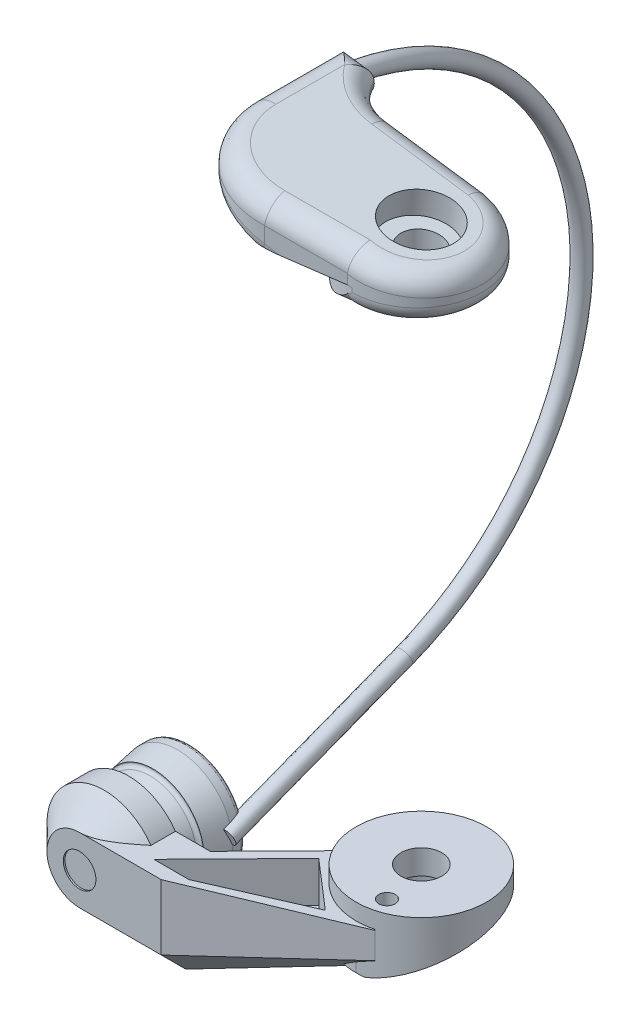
SolidWorks part; units mm, degrees
ref_plane "Plan1" through (0, 0, 0) normal (0, 0, 1) x (1, 0, 0)
ref_plane "Plan2" through (0, 0, 0) normal (0, 1, 0) x (1, 0, 0)
ref_plane "Plan3" through (0, 0, 0) normal (1, 0, 0) x (0, 0, -1)
sketch "Esquisse1" plane through (0, 0, 0) normal (0, 0, 1) x (1, 0, 0)
  circle A0 centre (0, 0) radius 7
  dimension "D1" = 14
extrude "Base-Extrusion" add sketch "Esquisse1" along normal blind 6
chamfer "Chanfrein1" distance 3 angle 45 1 edges at (7, 0, 6)
sketch "Esquisse2" plane through (0, 0, 0) normal (1, 0, 0) x (0, 0, -1)
  line L0 (-6, 4) -> (0, 4)
  line L1 (0, -7) -> (0, 7) construction
  line L2 (0, 4) -> (0, -7)
  line L3 (-3, -7) -> (-6, -4)
  line L4 (-3, -7) -> (-3, 7) construction
  line L5 (-6, -4) -> (-6, 4)
  line L6 (0, -7) -> (-3, -7)
extrude "Boss.-Extru.1" add sketch "Esquisse2" along normal blind 10
sketch "Esquisse3" plane through (0, 0, 0) normal (1, 0, 0) x (0, 0, -1)
  line L0 (9, 7.1) -> (9, -7) construction
ref_plane "Plan5" through (4.5, 0, -4.5) normal (0.7071, 0, -0.7071) x (-0.7071, 0, -0.7071)
ref_plane "Plan6" through (15.1066, 0, -15.1066) normal (0.7071, 0, -0.7071) x (-0.7071, 0, -0.7071)
sketch "Esquisse4" plane through (15.1066, 0, -15.1066) normal (0.7071, 0, -0.7071) x (-0.7071, 0, -0.7071)
  line L0 (-18.9434, 4) -> (-6.9434, 4)
  line L1 (-6.9434, 4) -> (-6.9434, -1.2)
  line L3 (-18.9434, 4) -> (-18.9434, 0.7848)
  line L5 (-6.9434, -1.2) -> (-16.7559, -1.2)
  line L6 (-18.9434, 0.7848) -> (-16.7559, -1.2)
  dimension "D1" = 12
sketch "Esquisse5" plane through (10, 0, 0) normal (1, 0, 0) x (0, 0, -1)
  line L0 (0, -7) -> (0, 4)
  line L1 (0, 4) -> (-6, 4)
  line L2 (-6, 4) -> (-6, -4)
  line L3 (-6, -4) -> (-3, -7)
  line L4 (-3, -7) -> (0, -7)
loft "Boss.-Lissage1" add profiles "Esquisse5", "Esquisse4"
sketch "Esquisse6" plane through (0, 4, 0) normal (0, 1, 0) x (-1, 0, 0)
  circle A0 centre (-26.3223, -9.5465) radius 8
  dimension "D1" = 16
  dimension "D2" = 28
extrude "Boss.-Extru.2" add sketch "Esquisse6" against normal blind 5.5
sketch "Esquisse7" plane through (0, -1.5, 0) normal (0, -1, 0) x (1, 0, 0)
  circle A0 centre (26.3223, -9.5465) radius 2.5
  dimension "D1" = 5
extrude "Enlèv. mat.-Extru.1" cut sketch "Esquisse7" against normal through all
sketch "Esquisse8" plane through (0, -1.5, 0) normal (0, -1, 0) x (1, 0, 0)
  circle A0 centre (26.3223, -9.5465) radius 4
  dimension "D1" = 8
extrude "Enlèv. mat.-Extru.2" cut sketch "Esquisse8" against normal blind 4.5
ref_plane "Plan7" through (8.3879, 0, 8.3879) normal (-0.7071, 0, -0.7071) x (-0.7071, 0, 0.7071)
sketch "Esquisse9" plane through (8.3879, 0, 8.3879) normal (-0.7071, 0, -0.7071) x (-0.7071, 0, 0.7071)
  line L0 (-20.5149, -1.5) -> (-33.3631, 3.7616)
  line L1 (-33.3631, 4) -> (-33.3631, -1.5) construction
  line L2 (-33.3631, 3.7616) -> (-33.3631, -1.5)
  line L3 (-33.3631, -1.5) -> (-20.5149, -1.5)
extrude "Enlèv. mat.-Extru.3" cut sketch "Esquisse9" against normal mid plane 18.5
sketch "Esquisse10" plane through (0, 4, 0) normal (0, 1, 0) x (-1, 0, 0)
  circle A0 centre (-26.3223, -9.5465) radius 8
extrude "Boss.-Extru.3" add sketch "Esquisse10" along normal blind 2
sketch "Esquisse11" plane through (0, 4, 0) normal (0, -1, 0) x (1, 0, 0)
  circle A0 centre (26.3223, -9.5465) radius 2.5
extrude "Enlèv. mat.-Extru.4" cut sketch "Esquisse11" against normal through all
sketch "Esquisse12" plane through (0, 4, 0) normal (0, 1, 0) x (-1, 0, 0)
  line L0 (-17.4, -5.9) -> (-23.3, -0.8)
  line L1 (-23.3, -0.8) -> (-11.7, 4.3)
  line L2 (-17.4, -5.9) -> (-7.3943, 4.3)
  line L3 (-7.3943, 4.3) -> (-11.7, 4.3)
extrude "Enlèv. mat.-Extru.6" cut sketch "Esquisse12" against normal blind 5
sketch "Esquisse13" plane through (0, 0, 0) normal (0, 0, -1) x (-1, 0, 0)
  circle A0 centre (0, 0) radius 5
  dimension "D1" = 10
extrude "Boss.-Extru.4" add sketch "Esquisse13" along normal blind 3 draft 15
sketch "Esquisse14" plane through (0, 0, -3) normal (0, 0, -1) x (-1, 0, 0)
  circle A0 centre (0, 0) radius 6.25
  dimension "D1" = 12.5
extrude "Boss.-Extru.5" add sketch "Esquisse14" along normal blind 3 draft 10
sketch "Esquisse15" plane through (0, 0, -6) normal (0, 0, -1) x (-1, 0, 0)
  circle A0 centre (0, 0) radius 6.779
extrude "Boss.-Extru.6" add sketch "Esquisse15" along normal blind 1.5
sketch "Esquisse16" plane through (0, 0, -7.5) normal (0, 0, -1) x (-1, 0, 0)
  circle A0 centre (0, 0) radius 3.5
  dimension "D1" = 7
extrude "Enlèv. mat.-Extru.7" cut sketch "Esquisse16" against normal blind 0.2
sketch "Esquisse17" plane through (0, 0, 6) normal (0, 0, 1) x (1, 0, 0)
  circle A0 centre (0, 0) radius 2
  dimension "D1" = 4
extrude "Enlèv. mat.-Extru.8" cut sketch "Esquisse17" against normal blind 0.2
fillet "Congé12" radius 0.5 3 edges at (5, 0, 0) (-5.8038, 0, -3) (-6.779, 0, -7.5)
ref_plane "Plan8" through (6.5, 0, 0) normal (1, 0, 0) x (0, 0, -1)
sketch "Esquisse19" plane through (6.5, 0, 0) normal (1, 0, 0) x (0, 0, -1)
  line L0 (6, 6.779) -> (6, -6.779) construction
  line L1 (6, 0) -> (27.6457, 8.3424) construction
  line L2 (6, 0) -> (27.6457, 8.3424)
  line L3 (0, 0) -> (0, 76) construction
  line L4 (0, 76) -> (15.3, 76) construction
  line L5 (0, 76) -> (15.3, 76)
  line L6 (0, 76) -> (50, 43.0304) construction
  arc A0 (15.3, 76) -> (27.6457, 8.3424) centre (15.0589, 41.0008) cw
  dimension "D2" = 35
  dimension "D1" = 76
  dimension "D3" = 50
sketch "Esquisse20" plane through (0, 0, 0) normal (0, 0, 1) x (1, 0, 0)
  line L0 (6.5, -50) -> (6.5, 50) construction
  circle A0 centre (6.5, 74.9414) radius 1
  dimension "D1" = 2
sweep "Boss.-Balayage1" add profiles "Esquisse20" path "Esquisse19"
ref_plane "Plan9" through (0, 5.8824, 0) normal (0, 1, 0) x (-1, 0, 0)
ref_plane "Plan10" through (0, 68.3824, 0) normal (0, 1, 0) x (-1, 0, 0)
sketch "Esquisse21" plane through (0, 68.3824, 0) normal (0, 1, 0) x (-1, 0, 0)
  line L0 (-25.1905, -1.6269) -> (-4.9, 1.2)
  line L2 (-4.9, 1.2) -> (-4.9, -21.2)
  line L5 (-26.3223, -17.5465) -> (-13.3173, -17.5465)
  line L6 (-4.9, -21.2) -> (-8.9, -21.2)
  line L7 (-8.9, -21.2) -> (-8.9, -17.5465)
  line L8 (-8.9, -17.5465) -> (-13.3173, -17.5465)
  arc A0 (-25.1905, -1.6269) -> (-26.3223, -17.5465) centre (-25.7564, -9.5867) ccw
extrude "Boss.-Extru.7" add sketch "Esquisse21" along normal blind 9
fillet "Congé13" radius 6 1 edges at (8.9, 72.8824, -17.5465)
fillet "Congé14" radius 10 1 edges at (4.9, 72.8824, 1.2)
sketch "Esquisse22" plane through (0, 0, -21.2) normal (0, 0, -1) x (-1, 0, 0)
  line L0 (-5.5, 73.4194) -> (-20.3722, 68.3824)
  line L1 (-5.5, 9.3275) -> (-5.5, 74.3821) construction
  line L2 (-26.3223, 68.3824) -> (-14.4221, 68.3824) construction
  line L3 (-4.9, 77.3824) -> (-33.7363, 73.4)
  line L4 (-33.7363, 77.3824) -> (-33.7363, 68.3824) construction
  line L5 (-33.7363, 73.4) -> (-33.7363, 79.5595)
  line L6 (-33.7363, 79.5595) -> (0, 79.5595)
  line L7 (0, 79.5595) -> (0, 73.4)
  line L8 (-5.5, 73.4194) -> (-4.9, 73.6226)
  line L9 (-4.9, 77.3824) -> (-4.9, 68.3824) construction
  line L10 (-4.9, 73.6226) -> (-4.9, 77.3824)
  line L11 (-20.3722, 68.3824) -> (0, 68.3824)
  line L12 (0, 68.3824) -> (0, 73.4)
extrude "Enlèv. mat.-Extru.9" cut sketch "Esquisse22" against normal through all
fillet "Congé17" radius 2.5 8 edges at (5.5272, 74.1464, -21.2) (4.9, 77.3824, -15.7449) (8.3349, 76.908, -2.7466) (6.9, 77.1062, -21.2) (11.1115, 76.5245, -18.5425) (20.3722, 75.2456, -17.5465) (33.7162, 73.4028, -9.0208) (20.7352, 75.1955, -1.0062)
fillet "Congé24" radius 2 6 edges at (33.7162, 68.3824, -9.0208) (23.3473, 68.3824, -17.5465) (8.3349, 72.4592, -2.7466) (22.7814, 68.3824, -1.2913) (20.3722, 68.3824, -9.2511) (18.3261, 69.0754, -0.6706)
fillet "Congé26" radius 1.5 16 edges at (4.9, 74.068, -10.2898) (11.1115, 71.5189, -18.5425) (4.9, 73.6226, -15.7449) (8.9, 73.287, -21.2) (4.9, 74.068, -21.2) (4.9, 74.5134, -15.7449) (4.9059, 74.6848, -21.2) (5.8907, 76.5064, -20.4678) (14.4446, 70.39, -17.5465) (8.044, 72.5578, -3.01) (18.3161, 69.0788, -1.1571) (17.9083, 69.2169, -17.1718) (20.3766, 68.409, -2.6473) (20.3766, 68.409, -15.8716)
sketch "Esquisse23" plane through (0, 3, 0) normal (0, -1, 0) x (1, 0, 0)
  circle A0 centre (26.3223, -9.5465) radius 2.5
extrude "Enlèv. mat.-Extru.10" cut sketch "Esquisse23" against normal through all
sketch "Esquisse24" plane through (10.5784, 76.5982, 0) normal (0.1368, 0.9906, 0) x (-0.9906, 0.1368, 0)
  line L2 (-25.254, -9.5465) -> (-25.6644, -9.5465) construction
  circle A0 centre (-15.8933, -9.5465) radius 4
  ellipse E0 centre (-15.8933, -9.5465) end of major axis (-18.4171, -9.5465) minor radius 2.5 construction
  dimension "D1" = 8
extrude "Enlèv. mat.-Extru.11" cut sketch "Esquisse24" against normal blind 3
sketch "Esquisse26" plane through (0, 68.3824, 0) normal (0, -1, 0) x (1, 0, 0)
  line L1 (19.5909, -13.7946) -> (16.5608, -15.7069)
  line L2 (16.5608, -15.7069) -> (13, 2.2)
  line L3 (26.3223, -1.5867) -> (26.3223, 2.2)
  line L4 (26.3223, 2.2) -> (13, 2.2)
  arc A0 (26.3223, -1.5867) -> (19.5909, -13.7946) centre (26.3223, -9.5465) ccw
extrude "Enlèv. mat.-Extru.13" cut sketch "Esquisse26" against normal blind 2.5
sketch "Esquisse27" plane through (0, 6, 0) normal (0, 1, 0) x (-1, 0, 0)
  circle A0 centre (-27.9025, -3.7583) radius 1
  dimension "D2" = 2
  dimension "D3" = 6
extrude "Enlèv. mat.-Extru.14" cut sketch "Esquisse27" against normal blind 2
sketch "Esquisse28" plane through (0, 68.3824, 0) normal (0, -1, 0) x (1, 0, 0)
  line L0 (25.2668, -6.6269) -> (25.2668, -3.6269)
  line L1 (29.3813, -10.0763) -> (31.7162, -10.0763)
  arc A0 (31.7162, -10.0763) -> (25.2668, -3.6269) centre (25.7564, -9.5867) ccw
  arc A2 (25.2668, -6.6269) -> (29.3813, -10.0763) centre (26.3223, -9.5465) cw
extrude "Enlèv. mat.-Extru.15" cut sketch "Esquisse28" against normal blind 2
